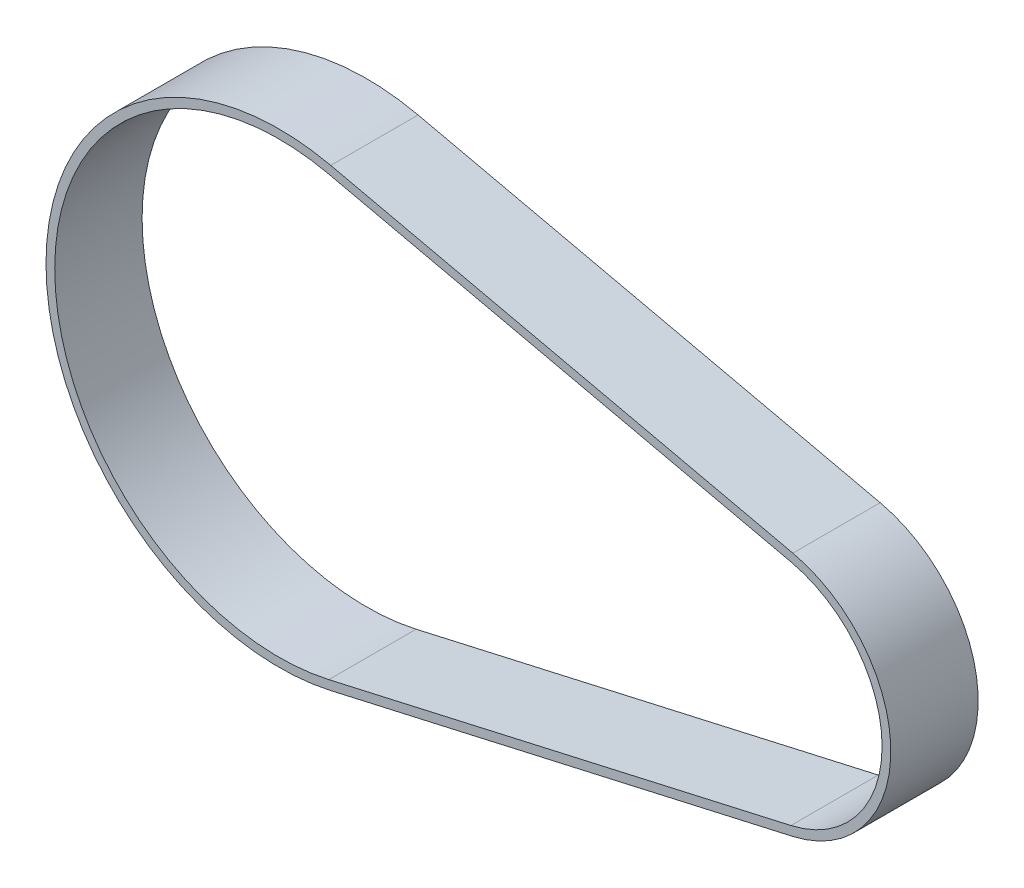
SolidWorks part; units mm, degrees
ref_plane "Front Plane" through (0, 0, 0) normal (0, 0, 1) x (1, 0, 0)
ref_plane "Top Plane" through (0, 0, 0) normal (0, 1, 0) x (1, 0, 0)
ref_plane "Right Plane" through (0, 0, 0) normal (1, 0, 0) x (0, 0, -1)
ref_plane "Plane1" through (0, 0, 10) normal (0, 0, 1) x (1, 0, 0)
sketch "Sketch1" plane through (0, 0, 10) normal (0, 0, 1) x (1, 0, 0)
  line L0 (5.9007, -26.0326) -> (58.7992, -14.0424)
  line L1 (58.7992, 14.0424) -> (5.9007, 26.0326)
  line L2 (5.6796, 25.0574) -> (58.5782, 13.0672)
  line L3 (58.5782, -13.0672) -> (5.6796, -25.0574)
  arc A0 (5.9007, 26.0326) -> (5.9007, -26.0326) centre (0, 0) ccw
  arc A1 (58.7992, -14.0424) -> (58.7992, 14.0424) centre (55.6163, 0) ccw
  arc A2 (5.6796, -25.0574) -> (5.6796, 25.0574) centre (0, 0) cw
  arc A3 (58.5782, 13.0672) -> (58.5782, -13.0672) centre (55.6163, 0) cw
  dimension "D1" = 1
extrude "Boss-Extrude1" add sketch "Sketch1" against normal blind 10
